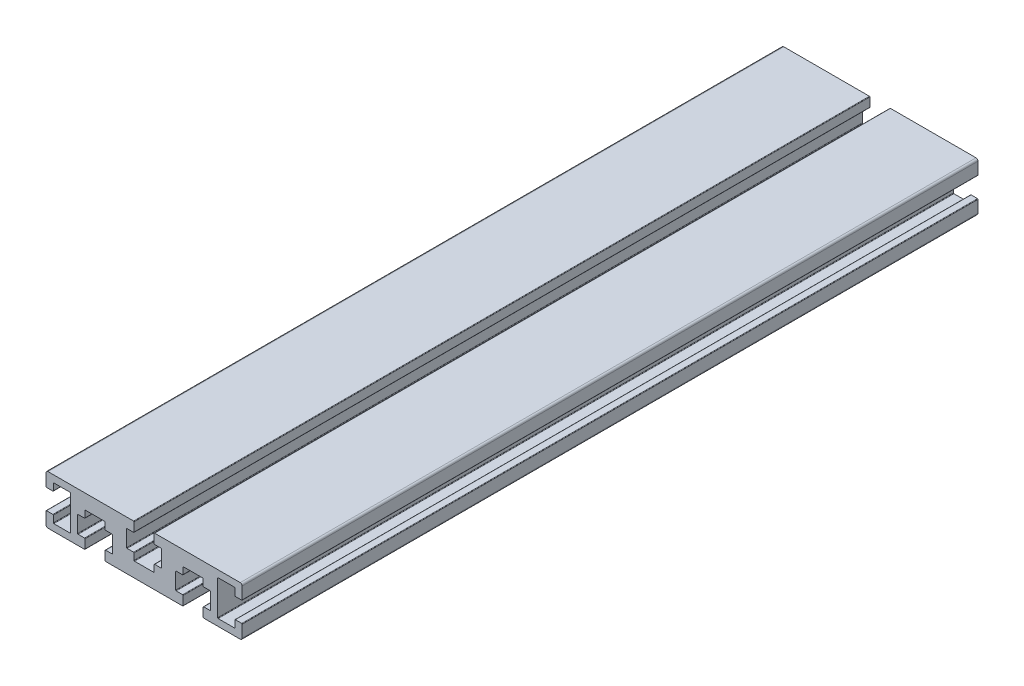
SolidWorks part; units mm, degrees
ref_plane "前视基准面" through (0, 0, 0) normal (0, 0, 1) x (1, 0, 0)
ref_plane "上视基准面" through (0, 0, 0) normal (0, 1, 0) x (1, 0, 0)
ref_plane "右视基准面" through (0, 0, 0) normal (1, 0, 0) x (0, 0, -1)
sketch "草图1"
sketch_block_instance "A$C60904AB1-1"
sketch_block "A$C60904AB1"
extrude "凸台-拉伸1" add sketch "草图1" along normal mid plane 300
